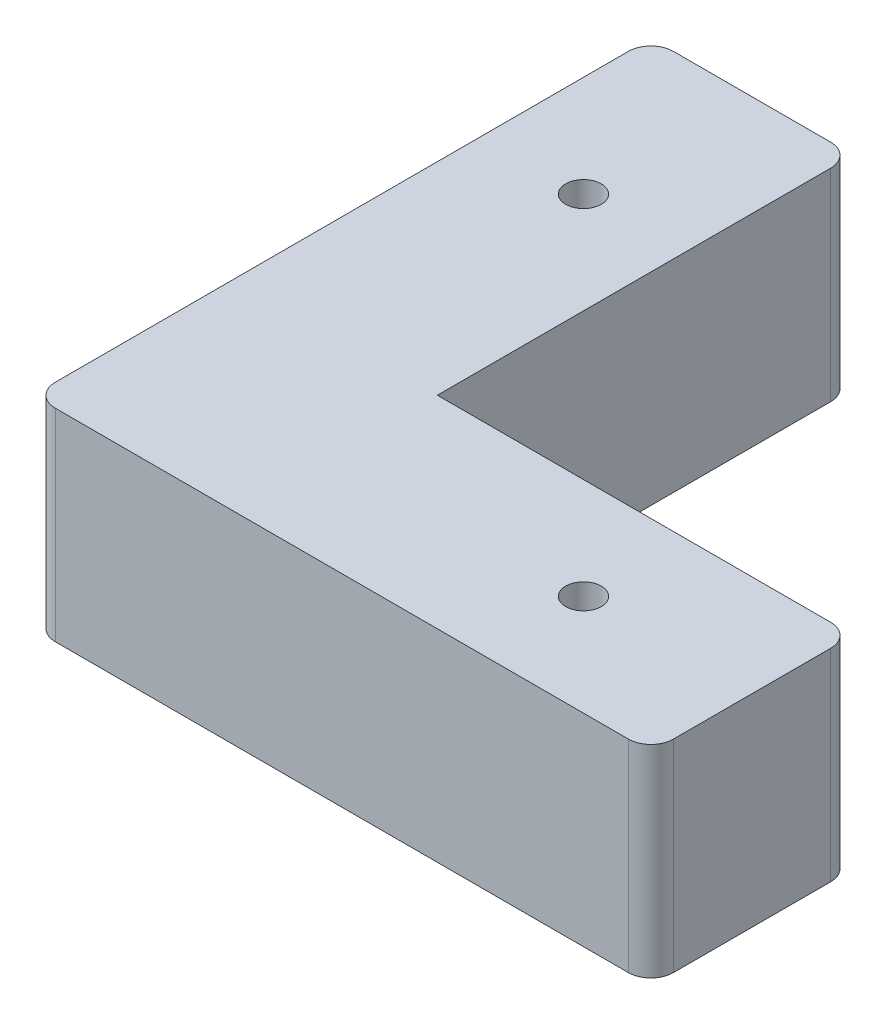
SolidWorks part; units mm, degrees
ref_plane "Plan de face" through (0, 0, 0) normal (0, 0, 1) x (1, 0, 0)
ref_plane "Plan de dessus" through (0, 0, 0) normal (0, 1, 0) x (1, 0, 0)
ref_plane "Plan de droite" through (0, 0, 0) normal (1, 0, 0) x (0, 0, -1)
sketch "Esquisse1" plane through (0, 0, 0) normal (0, 1, 0) x (1, 0, 0)
  line L0 (0, 55) -> (0, 0)
  line L1 (0, 0) -> (55, 0)
  line L2 (55, 0) -> (55, 18)
  line L3 (55, 18) -> (18, 18)
  line L4 (18, 18) -> (18, 55)
  line L5 (18, 55) -> (0, 55)
  line L6 (9, 55) -> (9, 40) construction
  line L7 (9, 40) -> (9, 9) construction
  line L8 (9, 9) -> (40, 9) construction
  circle A0 centre (9, 40) radius 1.585
  circle A1 centre (40, 9) radius 1.585
  point P15 (55, 9)
  dimension "D4" = 3.17
  dimension "D1" = 18
  dimension "D2" = 55
  dimension "D3" = 15
extrude "Boss.-Extru.1" add sketch "Esquisse1" along normal mid plane 18
fillet "Congé1" radius 2 5 edges at (0, 0, -55) (18, 0, -55) (55, 0, -18) (55, 0, 0) (0, 0, 0)
